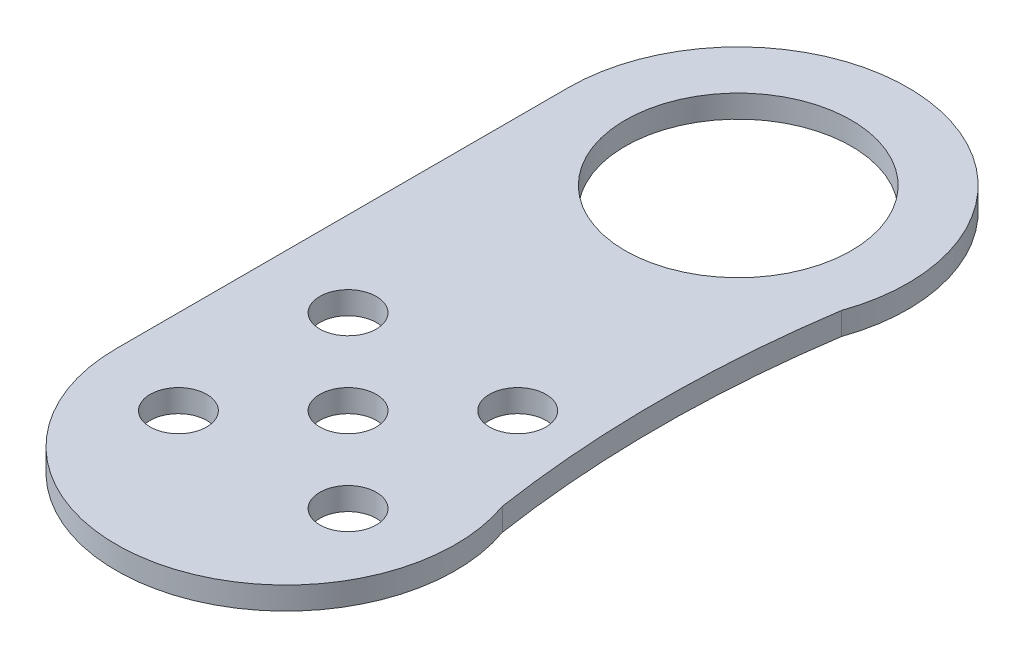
SolidWorks part; units mm, degrees
ref_plane "Front Plane" through (0, 0, 0) normal (0, 0, 1) x (1, 0, 0)
ref_plane "Top Plane" through (0, 0, 0) normal (0, 1, 0) x (1, 0, 0)
ref_plane "Right Plane" through (0, 0, 0) normal (1, 0, 0) x (0, 0, -1)
sketch "Sketch1" plane through (0, 0, 0) normal (0, 1, 0) x (1, 0, 0)
  line L0 (0, 0) -> (0, 40)
  line L1 (-30, 40) -> (-30, 0)
  arc A0 (0, 40) -> (-30, 40) centre (-15, 40) ccw
  arc A1 (-30, 0) -> (0, 0) centre (-15, 0) ccw
  arc A2 (0, 40) -> (-0.8579, 35) centre (-15, 40) cw
  arc A3 (0, 0) -> (-0.8579, 5) centre (-15, 0) ccw
  arc A4 (-0.8579, 35) -> (-0.8579, 5) centre (98.0107, 20) ccw
  point P7 (-15, 55)
  point P8 (-15, -15)
  point P12 (-1.9893, 20)
  point P13 (0, 20)
  dimension "D3" = 100
  dimension "D1" = 70
  dimension "D2" = 30
  dimension "D4" = 30
extrude "Boss-Extrude1" add sketch "Sketch1" along normal blind 2 contours A4 A2 A0 L1 A1 A3
sketch "Sketch2" plane through (0, 2, 0) normal (0, 1, 0) x (1, 0, 0)
  line L0 (-15, 55) -> (-15, -15) construction
  line L8 (-22.5, 13) -> (-7.5, 13) construction
  line L9 (-22.5, 13) -> (-22.5, -2) construction
  line L10 (-22.5, -2) -> (-7.5, -2) construction
  line L11 (-7.5, 13) -> (-7.5, -2) construction
  line L12 (-22.5, 13) -> (-7.5, -2) construction
  line L13 (-22.5, -2) -> (-7.5, 13) construction
  circle A2 centre (-15, 40) radius 10
  arc A7 (-0.8579, 35) -> (-30, 40) centre (-15, 40) ccw construction
  arc A8 (-30, 0) -> (-0.8579, 5) centre (-15, 0) ccw construction
  circle A9 centre (-22.5, 13) radius 2.5
  circle A10 centre (-7.5, 13) radius 2.5
  circle A11 centre (-15, 5.5) radius 2.5
  circle A12 centre (-7.5, -2) radius 2.5
  circle A13 centre (-22.5, -2) radius 2.5
  point P11 (-15, 5.5)
  dimension "D2" = 20
  dimension "D3" = 2
  dimension "D4" = 5
  dimension "D5" = 5
  dimension "D6" = 5
  dimension "D7" = 5
  dimension "D8" = 5
  dimension "D1" = 15
extrude "Cut-Extrude1" cut sketch "Sketch2" against normal through all and the other way through all
sketch "Sketch3" plane through (0, 0, 0) normal (0, -1, 0) x (1, 0, 0)
  line L1 (-30, 0) -> (-30, -40)
  line L2 (-29, 0) -> (-29, -40)
  line L3 (-29, 0) -> (-29, -40)
  arc A3 (-30, -40) -> (-0.8579, -35) centre (-15, -40) ccw
  arc A4 (-0.8579, -5) -> (-0.8579, -35) centre (98.0107, -20) ccw
  arc A5 (-0.8579, -5) -> (-30, 0) centre (-15, 0) ccw
  arc A6 (-1.832, -4.7543) -> (-1.832, -35.2457) centre (98.0107, -20) ccw
  arc A7 (-1.832, -4.7543) -> (-29, 0) centre (-15, 0) ccw
  arc A8 (-29, -40) -> (-1.832, -35.2457) centre (-15, -40) ccw
  arc A9 (-1.832, -4.7543) -> (-1.832, -35.2457) centre (98.0107, -20) ccw
  arc A10 (-1.832, -4.7543) -> (-29, 0) centre (-15, 0) ccw
  arc A11 (-29, -40) -> (-1.832, -35.2457) centre (-15, -40) ccw
  dimension "D1" = 1
  dimension "D2" = 1
